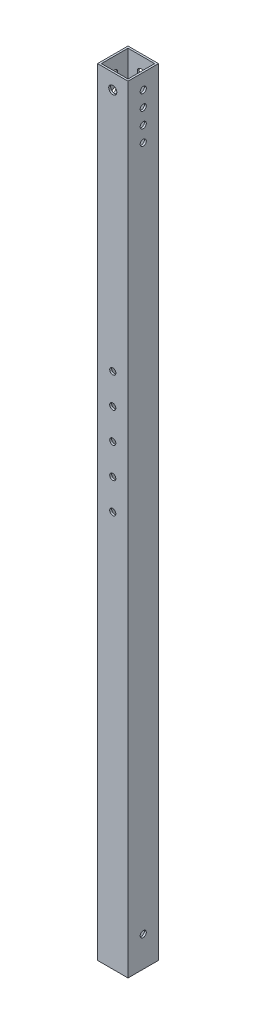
SolidWorks part; units mm, degrees
ref_plane "Front Plane" through (0, 0, 0) normal (0, 0, 1) x (1, 0, 0)
ref_plane "Top Plane" through (0, 0, 0) normal (0, 1, 0) x (1, 0, 0)
ref_plane "Right Plane" through (0, 0, 0) normal (1, 0, 0) x (0, 0, -1)
sketch "Sketch1" plane through (0, 0, 0) normal (0, 1, 0) x (1, 0, 0)
  line L1 (-12.7, -12.7) -> (12.7, -12.7)
  line L2 (-12.7, -12.7) -> (-12.7, 12.7)
  line L3 (-12.7, 12.7) -> (12.7, 12.7)
  line L4 (12.7, -12.7) -> (12.7, 12.7)
  line L5 (-12.7, -12.7) -> (12.7, 12.7) construction
  line L6 (-12.7, 12.7) -> (12.7, -12.7) construction
  line L7 (-11.1125, -11.1125) -> (11.1125, -11.1125)
  line L8 (-11.1125, -11.1125) -> (-11.1125, 11.1125)
  line L9 (-11.1125, 11.1125) -> (11.1125, 11.1125)
  line L10 (11.1125, -11.1125) -> (11.1125, 11.1125)
  line L11 (-11.1125, -11.1125) -> (11.1125, 11.1125) construction
  line L12 (-11.1125, 11.1125) -> (11.1125, -11.1125) construction
  point P0 (0, 0)
  point P6 (0, 0)
  dimension "D1" = 25.4
  dimension "D2" = 25.4
  dimension "D3" = 1.5875
extrude "Boss-Extrude1" add sketch "Sketch1" along normal blind 647.7
hole_wizard "#7 (0.201) Diameter Hole1" positions "Sketch2" profile "Sketch3" hole size "#7" standard "ANSI Inch"
sketch "Sketch2" plane through (0, 0, 12.7) normal (0, 0, 1) x (1, 0, 0)
  line L2 (-12.7, 647.7) -> (12.7, 647.7) construction
  point P0 (0, 330.2)
  point P29 (0, 355.6)
  point P30 (0, 381)
  point P31 (0, 406.4)
  point P32 (0, 431.8)
  dimension "D1" = 317.5
  dimension "D3" = 25.4
  dimension "D2" = 5
sketch "Sketch3" plane through (0, 330.2, 12.7) normal (1, 0, 0) x (0, -1, 0)
  line L0 (0, 0) -> (0, 25.4)
  line L1 (0, 25.4) -> (2.5527, 25.4)
  line L2 (2.5527, 25.4) -> (2.5527, 0)
  line L5 (2.5527, 0) -> (0, 0)
  line L11 (0, -6.35) -> (0, 107.95) construction
  dimension "Thru Hole Dia." = 5.1054
  dimension "Thru Hole Depth" = 25.4
hole_wizard "#7 (0.201) Diameter Hole2" positions "Sketch4" profile "Sketch5" hole size "#7" standard "ANSI Inch"
sketch "Sketch4" plane through (12.7, 0, 0) normal (1, 0, 0) x (0, 0, -1)
  line L0 (-12.7, 647.7) -> (12.7, 647.7) construction
  line L1 (-12.7, 0) -> (12.7, 0) construction
  point P0 (0, 635)
  point P13 (0, 622.3)
  point P14 (0, 609.6)
  point P15 (0, 596.9)
  point P16 (0, 25.4)
  point P25 (0, 0)
  point P26 (0, 0)
  dimension "D1" = 12.7
  dimension "D3" = 12.7
  dimension "D5" = 25.4
  dimension "D2" = 4
sketch "Sketch5" plane through (12.7, 635, 0) normal (0, 1, 0) x (0, 0, -1)
  line L0 (0, 0) -> (0, 25.4)
  line L1 (0, 25.4) -> (2.5527, 25.4)
  line L2 (2.5527, 25.4) -> (2.5527, 0)
  line L5 (2.5527, 0) -> (0, 0)
  line L11 (0, -6.35) -> (0, 107.95) construction
  dimension "Thru Hole Dia." = 5.1054
  dimension "Thru Hole Depth" = 25.4
hole_wizard "17/64 (0.26563) Diameter Hole1" positions "Sketch6" profile "Sketch7" hole size "17/64" standard "ANSI Inch"
sketch "Sketch6" plane through (0, 0, -12.7) normal (0, 0, -1) x (-1, 0, 0)
  line L0 (-12.7, 647.7) -> (12.7, 647.7) construction
  point P0 (0, 635)
  point P5 (0, 0)
  dimension "D1" = 12.7
sketch "Sketch7" plane through (0, 635, -12.7) normal (1, 0, 0) x (0, 1, 0)
  line L0 (0, 0) -> (0, 25.4)
  line L1 (0, 25.4) -> (3.3735, 25.4)
  line L2 (3.3735, 25.4) -> (3.3735, 0)
  line L5 (3.3735, 0) -> (0, 0)
  line L11 (0, -6.35) -> (0, 107.95) construction
  dimension "Thru Hole Dia." = 6.747
  dimension "Thru Hole Depth" = 25.4
